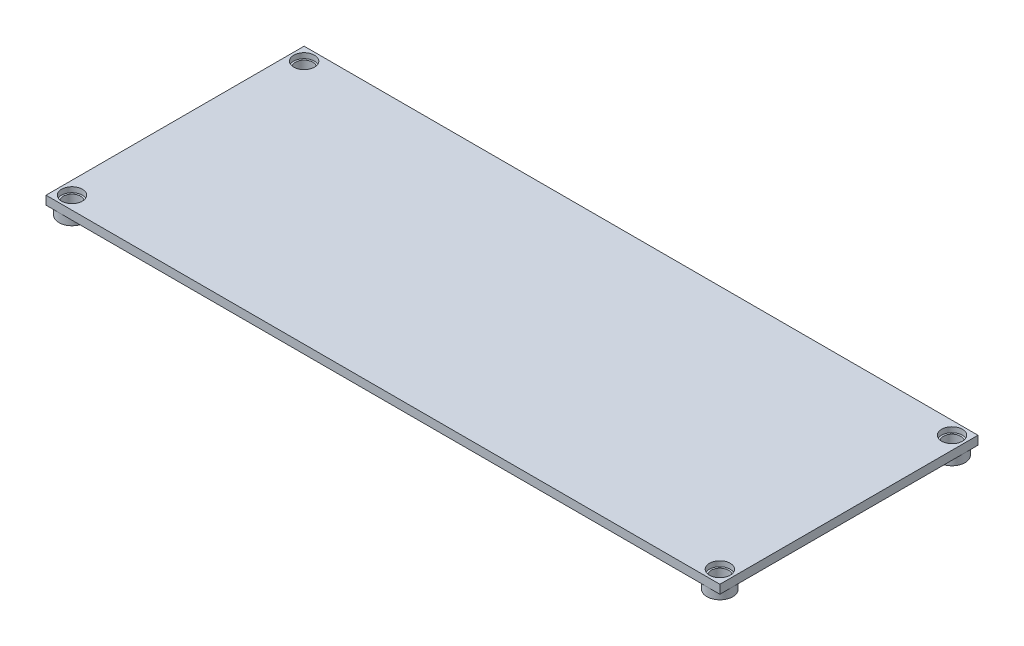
SolidWorks part; units mm, degrees
ref_plane "前视基准面" through (0, 0, 0) normal (0, 0, 1) x (1, 0, 0)
ref_plane "上视基准面" through (0, 0, 0) normal (0, 1, 0) x (1, 0, 0)
ref_plane "右视基准面" through (0, 0, 0) normal (1, 0, 0) x (0, 0, -1)
sketch "草图1" plane through (0, 0, 0) normal (0, 1, 0) x (1, 0, 0)
  line L1 (-97.25, -37.25) -> (97.25, -37.25)
  line L2 (-97.25, -37.25) -> (-97.25, 37.25)
  line L3 (-97.25, 37.25) -> (97.25, 37.25)
  line L4 (97.25, -37.25) -> (97.25, 37.25)
  line L5 (-97.25, -37.25) -> (97.25, 37.25) construction
  line L6 (-97.25, 37.25) -> (97.25, -37.25) construction
  point P0 (0, 0)
  dimension "D1" = 194.5
  dimension "D2" = 74.5
extrude "凸台-拉伸1" add sketch "草图1" along normal blind 2.5
sketch "草图2" plane through (0, 2.5, 0) normal (0, 1, 0) x (1, 0, 0)
  line L2 (0, -1000) -> (0, 49000) construction
  line L3 (-97.5, 37.5) -> (97.5, 37.5) construction
  line L4 (-97.5, 37.5) -> (-97.5, -37.5) construction
  line L5 (-97.5, -37.5) -> (97.5, -37.5) construction
  line L6 (97.5, 37.5) -> (97.5, -37.5) construction
  line L7 (-97.5, 37.5) -> (97.5, -37.5) construction
  line L8 (-97.5, -37.5) -> (97.5, 37.5) construction
  line L9 (-1000, 0) -> (49000, 0) construction
  circle A0 centre (-93.5, 33.5) radius 4 construction
  circle A1 centre (93.5, 33.5) radius 4 construction
  circle A2 centre (93.5, -33.5) radius 4 construction
  circle A3 centre (-93.5, -33.5) radius 4 construction
  circle A4 centre (-93.5, 33.5) radius 3
  circle A5 centre (93.5, 33.5) radius 3
  circle A6 centre (93.5, -33.5) radius 3
  circle A7 centre (-93.5, -33.5) radius 3
  point P0 (0, 0)
  dimension "D1" = 195
  dimension "D3" = 8
  dimension "D4" = 6
  dimension "D2" = 75
extrude "切除-拉伸2" cut sketch "草图2" against normal blind 1.5
sketch "草图3" plane through (0, 0, 0) normal (0, -1, 0) x (1, 0, 0)
  line L0 (-97.25, 37.25) -> (97.25, 37.25) construction
  circle A0 centre (-93.5, -33.5) radius 3 construction
  circle A1 centre (-93.5, 33.5) radius 3 construction
  circle A2 centre (93.5, 33.5) radius 3 construction
  circle A3 centre (93.5, -33.5) radius 3 construction
  circle A4 centre (-93.5, -33.5) radius 3 construction
  circle A5 centre (-93.5, 33.5) radius 3 construction
  circle A6 centre (93.5, 33.5) radius 3 construction
  circle A7 centre (93.5, -33.5) radius 3 construction
  circle A8 centre (-93.5, 33.5) radius 3.75
  circle A9 centre (93.5, -33.5) radius 3.75
  circle A10 centre (-93.5, -33.5) radius 3.75
  circle A11 centre (93.5, 33.5) radius 3.75
extrude "凸台-拉伸2" add sketch "草图3" along normal blind 2.5
sketch "草图4" plane through (0, 1, 0) normal (0, 1, 0) x (1, 0, 0)
  circle A0 centre (-93.5, 33.5) radius 2.5
  circle A1 centre (-93.5, -33.5) radius 2.5
  circle A2 centre (93.5, 33.5) radius 2.5
  circle A3 centre (93.5, -33.5) radius 2.5
  dimension "D1" = 5
extrude "切除-拉伸3" cut sketch "草图4" against normal up to next
